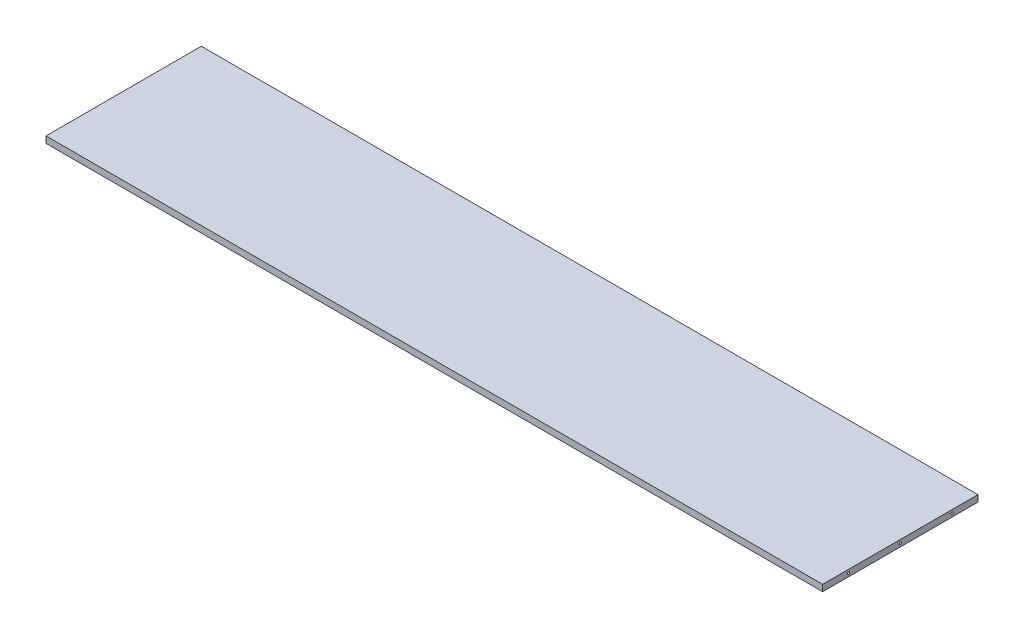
SolidWorks part; units mm, degrees
ref_plane "Front Plane" through (0, 0, 0) normal (0, 0, 1) x (1, 0, 0)
ref_plane "Top Plane" through (0, 0, 0) normal (0, 1, 0) x (1, 0, 0)
ref_plane "Right Plane" through (0, 0, 0) normal (1, 0, 0) x (0, 0, -1)
sketch "Sketch1" plane through (0, 0, 0) normal (0, 1, 0) x (1, 0, 0)
  line L1 (-381, -76.2) -> (381, -76.2)
  line L2 (-381, -76.2) -> (-381, 76.2)
  line L3 (-381, 76.2) -> (381, 76.2)
  line L4 (381, -76.2) -> (381, 76.2)
  line L5 (-381, -76.2) -> (381, 76.2) construction
  line L6 (-381, 76.2) -> (381, -76.2) construction
  point P0 (0, 0)
extrude "Boss-Extrude1" add sketch "Sketch1" along normal blind 6.35
hole_wizard "#4-40 Tapped Hole1" positions "Sketch2" profile "Sketch3" tap size "#4-40" standard "ANSI Inch"
sketch "Sketch2" plane through (381, 0, 0) normal (1, 0, 0) x (0, 0, -1)
  line L0 (-76.2, 6.35) -> (76.2, 6.35) construction
  point P0 (0, 3.175)
  point P2 (50.8, 3.175)
  point P4 (-50.8, 3.175)
  dimension "D1" = 50.8
  dimension "D2" = 50.8
  dimension "D3" = 0
  dimension "D4" = 3.175
sketch "Sketch3" plane through (381, 3.175, 0) normal (0, 1, 0) x (0, 0, -1)
  line L0 (0, 0) -> (0, 8.2738)
  line L1 (0, 8.2738) -> (1.1303, 7.5946)
  line L2 (1.1303, 7.5946) -> (1.1303, 0)
  line L5 (1.1303, 0) -> (0, 0)
  line L10 (0, 8.2738) -> (-1.1303, 7.5946) construction
  line L11 (0, -6.35) -> (0, 107.95) construction
  dimension "Tap Drill Dia." = 2.2606
  dimension "Tap Drill Depth" = 7.5946
  dimension "Drill Angle" = 118
hole_wizard "#4-40 Tapped Hole2" positions "Sketch4" profile "Sketch5" tap size "#4-40" standard "ANSI Inch"
sketch "Sketch4" plane through (-381, 0, 0) normal (-1, 0, 0) x (0, 0, 1)
  line L0 (-76.2, 0) -> (76.2, 0) construction
  point P0 (0, 3.175)
  point P2 (50.8, 3.175)
  point P4 (-50.8, 3.175)
  point P6 (0, 0)
  dimension "D1" = 50.8
  dimension "D2" = 50.8
  dimension "D3" = 3.175
  dimension "D4" = 0
sketch "Sketch5" plane through (-381, 3.175, 0) normal (0, 1, 0) x (0, 0, 1)
  line L0 (0, 0) -> (0, 8.2738)
  line L1 (0, 8.2738) -> (1.1303, 7.5946)
  line L2 (1.1303, 7.5946) -> (1.1303, 0)
  line L5 (1.1303, 0) -> (0, 0)
  line L10 (0, 8.2738) -> (-1.1303, 7.5946) construction
  line L11 (0, -6.35) -> (0, 107.95) construction
  dimension "Tap Drill Dia." = 2.2606
  dimension "Tap Drill Depth" = 7.5946
  dimension "Drill Angle" = 118
